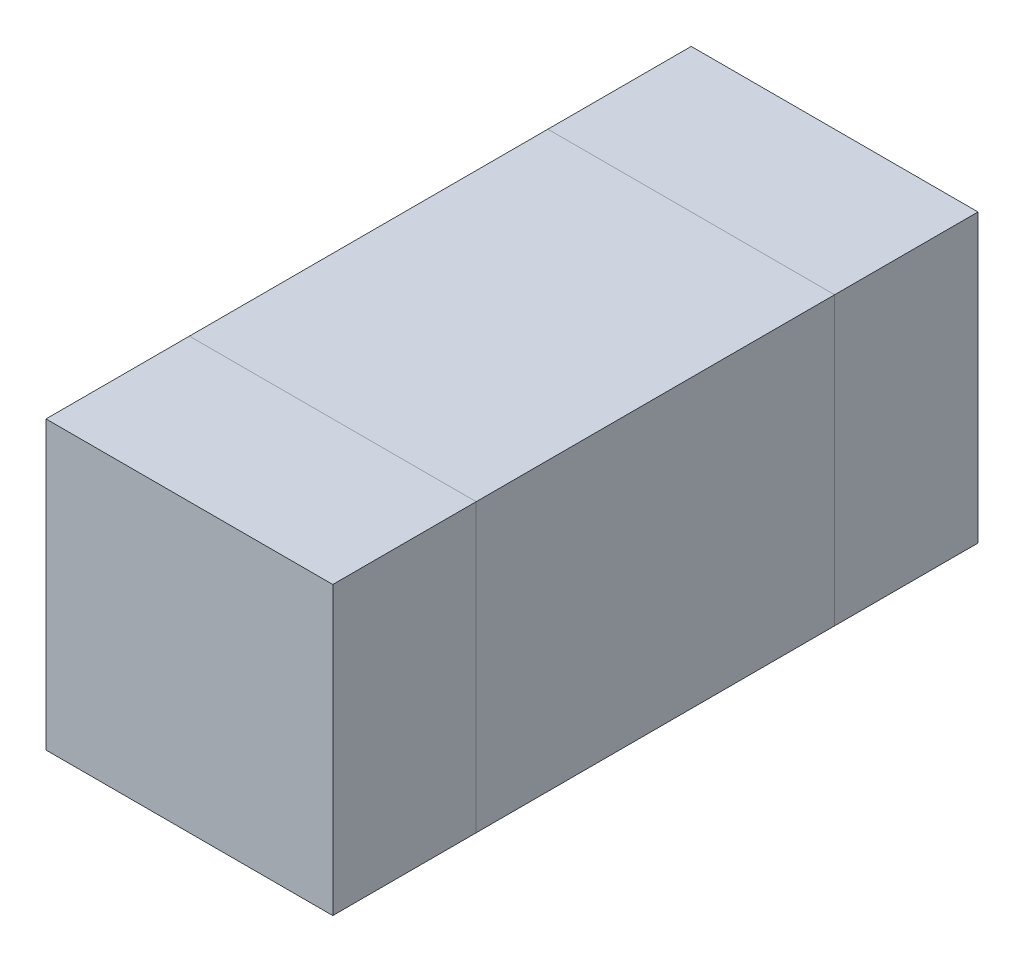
SolidWorks part; units mm, degrees
ref_plane "Front Plane" through (0, 0, 0) normal (0, 0, 1) x (1, 0, 0)
ref_plane "Top Plane" through (0, 0, 0) normal (0, 1, 0) x (1, 0, 0)
ref_plane "Right Plane" through (0, 0, 0) normal (1, 0, 0) x (0, 0, -1)
sketch "MainBodyS" plane through (0, 0, 0) normal (0, 1, 0) x (1, 0, 0)
  line L1 (-0.4, 0.5) -> (0.4, 0.5)
  line L2 (-0.4, 0.5) -> (-0.4, -0.5)
  line L3 (-0.4, -0.5) -> (0.4, -0.5)
  line L4 (0.4, 0.5) -> (0.4, -0.5)
  line L5 (-0.4, 0.5) -> (0.4, -0.5) construction
  line L6 (-0.4, -0.5) -> (0.4, 0.5) construction
  point P0 (0, 0)
  dimension "Length" = 1
  dimension "Width" = 0.8
extrude "MainBody" add sketch "MainBodyS" along normal blind 0.8
sketch "LeftBodyS" plane through (0, 0, 0) normal (0, -1, 0) x (-1, 0, 0)
  line L1 (0.4, -0.5) -> (-0.4, -0.5)
  line L2 (0.4, -0.5) -> (0.4, -0.9)
  line L3 (0.4, -0.9) -> (-0.4, -0.9)
  line L4 (-0.4, -0.5) -> (-0.4, -0.9)
  dimension "Width" = 0.4
extrude "Boss-Extrude1" add sketch "LeftBodyS" against normal up to surface (0.8 mm away) separate body
sketch "RightBodyS" plane through (0, 0, 0) normal (0, -1, 0) x (1, 0, 0)
  line L0 (0.4, 0.5) -> (0.4, 0.9) construction
  line L1 (-0.4, -0.5) -> (0.4, -0.5)
  line L2 (-0.4, -0.5) -> (-0.4, -0.9)
  line L3 (-0.4, -0.9) -> (0.4, -0.9)
  line L4 (0.4, -0.5) -> (0.4, -0.9)
extrude "Boss-Extrude2" add sketch "RightBodyS" against normal up to surface (0.8 mm away) separate body
